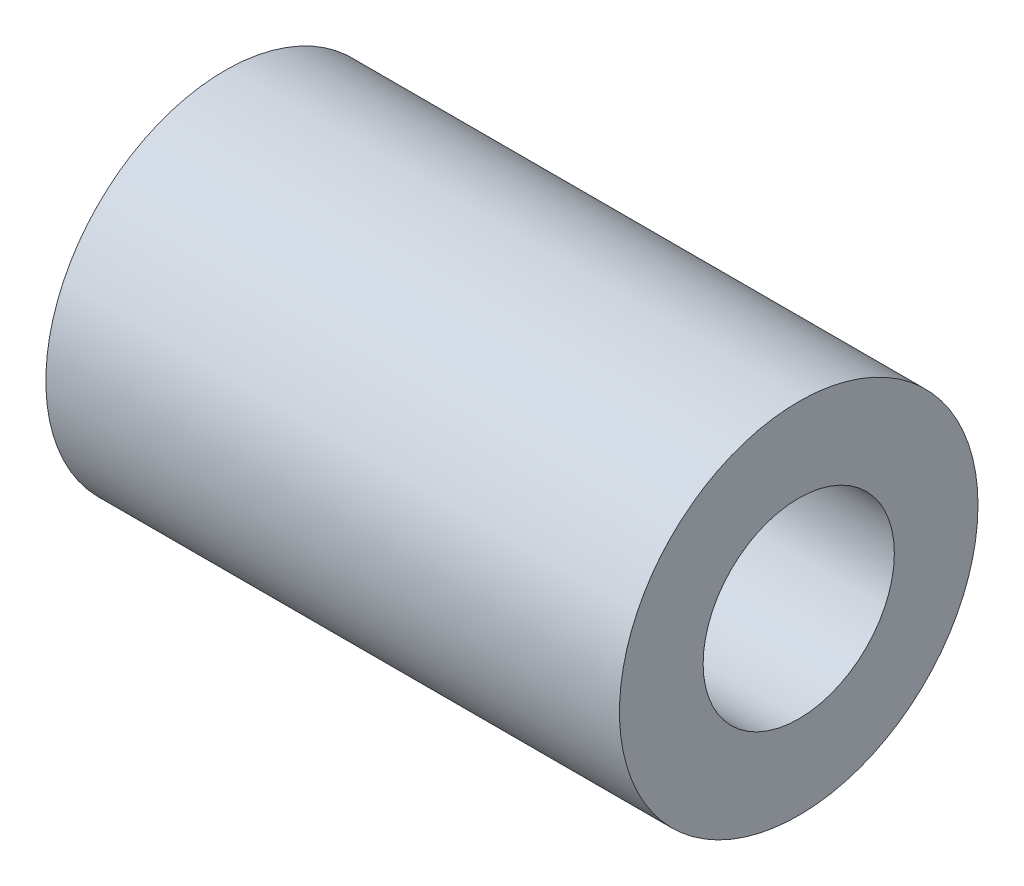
SolidWorks part; units mm, degrees
ref_plane "Ebene vorne" through (0, 0, 0) normal (0, 0, 1) x (1, 0, 0)
ref_plane "Ebene oben" through (0, 0, 0) normal (0, 1, 0) x (1, 0, 0)
ref_plane "Ebene rechts" through (0, 0, 0) normal (1, 0, 0) x (0, 0, -1)
sketch "Skizze1" plane through (0, 0, 0) normal (1, 0, 0) x (0, 0, -1)
  circle A0 centre (0, 0) radius 4
  circle A1 centre (0, 0) radius 7.5
  dimension "D1" = 8
  dimension "D2" = 15
extrude "Aufsatz-Linear austragen1" add sketch "Skizze1" along normal mid plane 24
